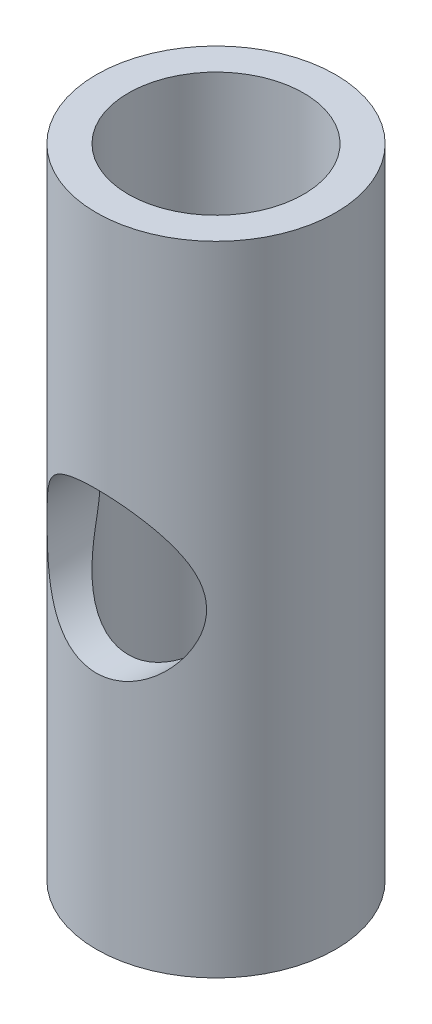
SolidWorks part; units mm, degrees
ref_plane "Front Plane" through (0, 0, 0) normal (0, 0, 1) x (1, 0, 0)
ref_plane "Top Plane" through (0, 0, 0) normal (0, 1, 0) x (1, 0, 0)
ref_plane "Right Plane" through (0, 0, 0) normal (1, 0, 0) x (0, 0, -1)
sketch "Sketch1" plane through (0, 0, 0) normal (0, 1, 0) x (1, 0, 0)
  circle A0 centre (0, 0) radius 1.1
  circle A1 centre (0, 0) radius 1.5
  dimension "D1" = 2.2
  dimension "D2" = 3
extrude "Extrude1" add sketch "Sketch1" along normal blind 8
sketch "Sketch2" plane through (0, 0, 0) normal (0, 0, 1) x (1, 0, 0)
  circle A0 centre (0, 4) radius 1
  dimension "D1" = 2
  dimension "D2" = 4
extrude "Cut-Extrude1" cut sketch "Sketch2" along normal through all
